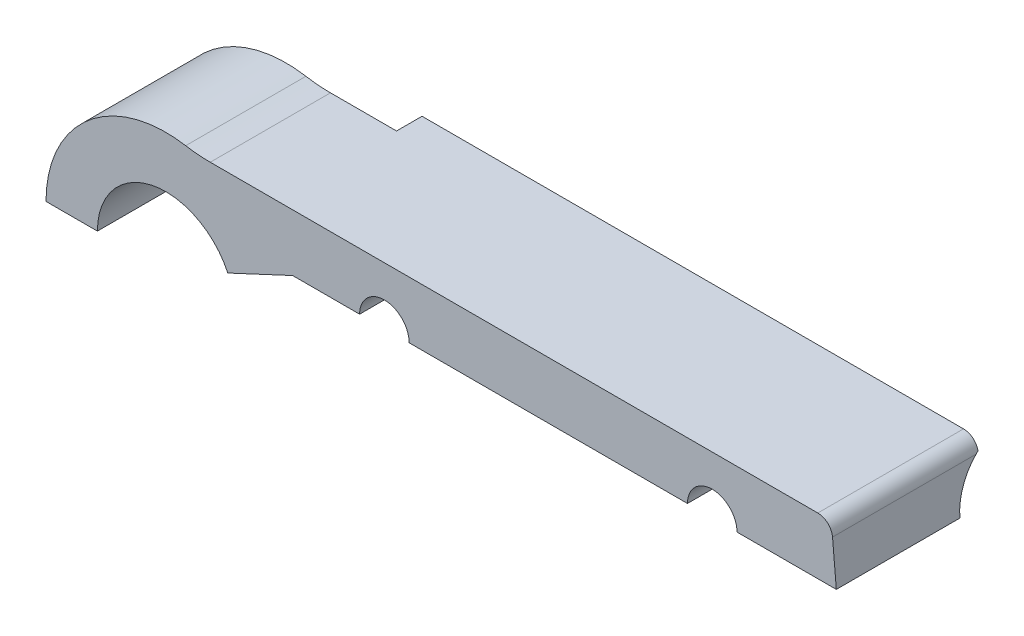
SolidWorks part; units mm, degrees
ref_plane "Plan1" through (0, 0, 0) normal (0, 0, 1) x (1, 0, 0)
ref_plane "Plan2" through (0, 0, 0) normal (0, 1, 0) x (1, 0, 0)
ref_plane "Plan3" through (0, 0, 0) normal (1, 0, 0) x (0, 0, -1)
sketch "Esquisse1" plane through (0, 0, 0) normal (0, 0, 1) x (1, 0, 0)
  line L0 (-20, 0) -> (30, 0) construction
  line L1 (-20, 8.12) -> (103.692, 8.12) construction
  line L2 (6.1008, 15.935) -> (89.4898, 15.935)
  line L3 (91.5121, 14.0819) -> (92.0337, 8.12)
  line L4 (91.5121, 2.1581) -> (92.0337, 8.12)
  line L5 (30.8285, 0.305) -> (89.4898, 0.305)
  arc A0 (2.7304, 16.2168) -> (13.7971, -8.9486) centre (0, 0) ccw
  arc A1 (89.4898, 15.935) -> (91.5121, 14.0819) centre (89.4898, 13.905) cw
  arc A2 (89.4898, 0.305) -> (91.5121, 2.1581) centre (89.4898, 2.335) ccw
  arc A3 (30.8285, 0.305) -> (13.7971, -8.9486) centre (30.8285, -19.995) ccw
  arc A4 (2.7304, 16.2168) -> (6.1008, 15.935) centre (6.1008, 36.235) ccw
  point P4 (0, 0)
  point P12 (91.35, 15.935)
  dimension "D1" = 32.89
  dimension "D6" = 2.03
  dimension "D7" = 20.3
  dimension "D8" = 20.3
  dimension "D2" = 8.12
  dimension "D3" = 7.815
  dimension "D4" = 85
  dimension "D5" = 91.35
extrude "Base-Extrusion" add sketch "Esquisse1" along normal blind 20
sketch "Esquisse3" plane through (0, 0, 0) normal (0, 0, -1) x (-1, 0, 0)
  circle A0 centre (0, 0) radius 22
  dimension "D1" = 44
extrude "Enlèv. mat.-Extru.1" cut sketch "Esquisse3" against normal blind 3.5
ref_plane "Plan4" through (95, 0, 0) normal (1, 0, 0) x (0, 0, -1)
sketch "Esquisse4" plane through (95, 0, 0) normal (1, 0, 0) x (0, 0, -1)
  line L0 (-29.432, 8.12) -> (41.2048, 8.12) construction
  line L1 (4.77, 36.235) -> (4.77, -26.2926) construction
  line L2 (-20, 36.235) -> (-3.5, 36.235) construction
  line L3 (-3.5, -16.445) -> (-3.5, 16.445) construction
  circle A0 centre (4.77, 8.12) radius 7.815
  dimension "D1" = 15.63
  dimension "D2" = 8.27
extrude "Enlèv. mat.-Extru.2" cut sketch "Esquisse4" against normal through all
sketch "Esquisse5" plane through (0, 0, 3.5) normal (0, 0, -1) x (-1, 0, 0)
  circle A0 centre (0, 0) radius 9.39
  dimension "D1" = 18.78
extrude "Enlèv. mat.-Extru.3" cut sketch "Esquisse5" against normal through all
hole_wizard "Trou taraudé M8x1.252" positions "Esquisse10" profile "Esquisse9" tap size "M8x1.25" standard "ISO"
sketch "Esquisse10" plane through (0, 0, 20) normal (0, 0, 1) x (1, 0, 0)
  line L0 (-31.8868, 8.12) -> (14.4386, 8.12) construction
  point P0 (30, 8.12)
  point P1 (75, 8.12)
  dimension "D1" = 45
  dimension "D2" = 30
sketch "Esquisse9" plane through (30, 8.12, 20) normal (1, 0, 0) x (0, -1, 0)
  line L0 (0, 0) -> (0, 20.7893)
  line L1 (0, 20.7893) -> (3.4, 20.7893)
  line L2 (3.4, 20.7893) -> (3.4, 0)
  line L5 (3.4, 0) -> (0, 0)
  line L11 (0, -6.35) -> (0, 107.95) construction
  dimension "Diamètre du perçage jusqu'au prochain" = 6.8
  dimension "Profondeur du perçage jusqu'au prochain" = 20.7893
sketch "Esquisse11" plane through (0, 0, 3.5) normal (0, 0, -1) x (-1, 0, 0)
  line L0 (19.6289, 0) -> (0, 0)
  line L1 (0, 0) -> (-17.4134, 8.12)
  line L2 (-21.9152, 8.12) -> (-71.6, 8.12) construction
  line L3 (-17.4134, 8.12) -> (-96.3547, 8.12)
  dimension "D1" = 25
extrude "Enlèv. mat.-Extru.4" cut sketch "Esquisse11" against normal through all and the other way through all
